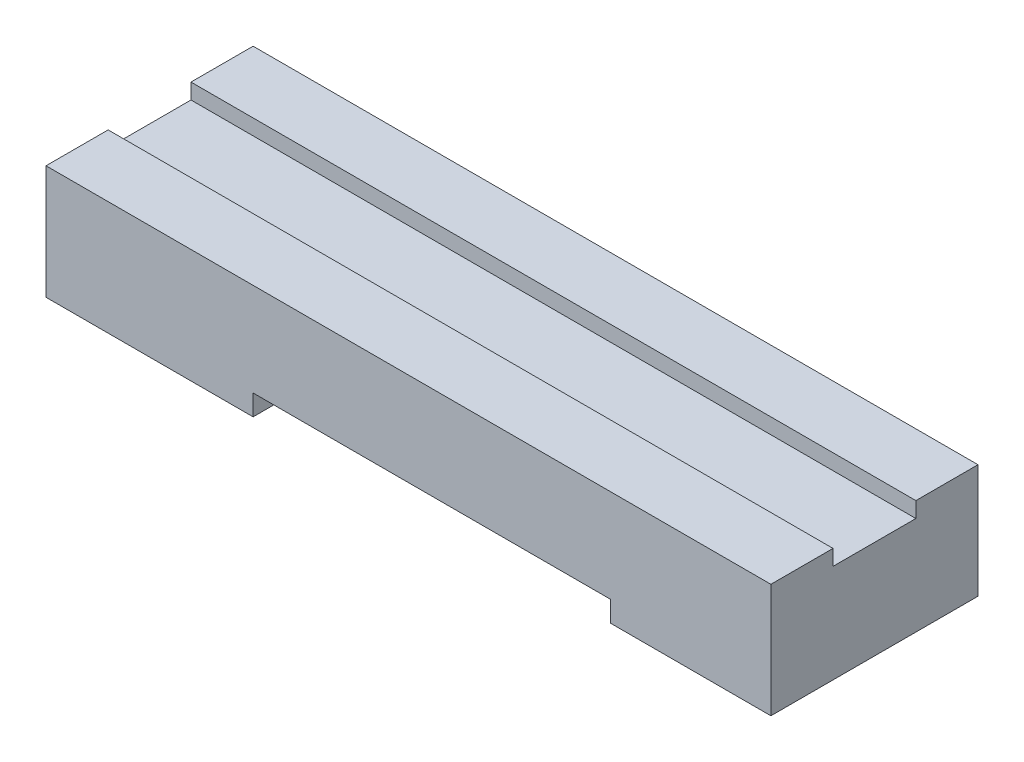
SolidWorks part; units mm, degrees
ref_plane "Face" through (0, 0, 0) normal (0, 0, 1) x (1, 0, 0)
ref_plane "Dessus" through (0, 0, 0) normal (0, 1, 0) x (1, 0, 0)
ref_plane "Droite" through (0, 0, 0) normal (1, 0, 0) x (0, 0, -1)
sketch "Esquisse3" plane through (0, 0, 0) normal (0, 0, 1) x (1, 0, 0)
  line L0 (-700, 110) -> (700, -110) construction
  line L1 (-700, 110) -> (700, 110)
  line L2 (-700, 110) -> (-700, -110)
  line L3 (-700, -110) -> (700, -110)
  line L4 (700, 110) -> (700, -110)
  dimension "D1" = 1400
  dimension "D2" = 220
extrude "Extrusion2" add sketch "Esquisse3" along normal blind 400
sketch "Esquisse4" plane through (0, 0, 400) normal (0, 0, 1) x (1, 0, 0)
  line L0 (-700, 110) -> (-700, -110) construction
  line L1 (-300, -70) -> (390, -70)
  line L2 (-300, -70) -> (-300, -110)
  line L3 (-300, -110) -> (390, -110)
  line L4 (390, -70) -> (390, -110)
  line L5 (700, -110) -> (700, 110) construction
  line L6 (-700, -110) -> (700, -110) construction
  dimension "D1" = 400
  dimension "D2" = 310
  dimension "D3" = 40
extrude "Enlèv. mat.-Extru.1" cut sketch "Esquisse4" against normal through all
sketch "Esquisse5" plane through (-700, 0, 0) normal (-1, 0, 0) x (0, 0, 1)
  line L0 (400, 110) -> (0, 110) construction
  line L1 (120, 110) -> (280, 110)
  line L2 (120, 110) -> (120, 80)
  line L3 (120, 80) -> (280, 80)
  line L4 (280, 110) -> (280, 80)
  line L5 (400, 110) -> (400, -110) construction
  line L6 (0, 110) -> (0, -110) construction
  dimension "D1" = 120
  dimension "D2" = 120
  dimension "D3" = 30
extrude "Enlèv. mat.-Extru.2" cut sketch "Esquisse5" against normal through all
